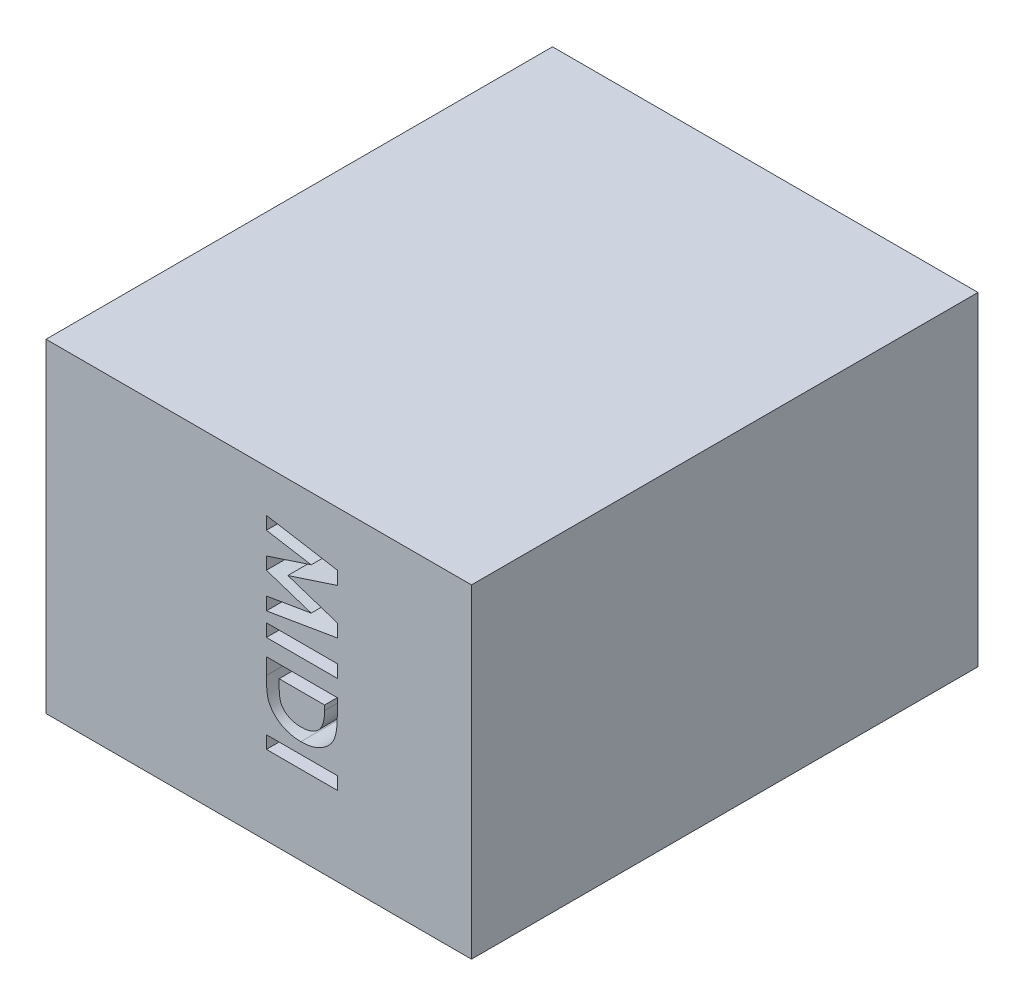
SolidWorks part; units mm, degrees
ref_plane "Plan de face" through (0, 0, 0) normal (0, 0, 1) x (1, 0, 0)
ref_plane "Plan de dessus" through (0, 0, 0) normal (0, 1, 0) x (1, 0, 0)
ref_plane "Plan de droite" through (0, 0, 0) normal (1, 0, 0) x (0, 0, -1)
sketch "Esquisse1" plane through (0, 0, 0) normal (0, 0, 1) x (1, 0, 0)
  line L1 (-34.0569, 3.6786) -> (-13.0569, 3.6786)
  line L2 (-34.0569, 3.6786) -> (-34.0569, -12.3214)
  line L3 (-34.0569, -12.3214) -> (-13.0569, -12.3214)
  line L4 (-13.0569, 3.6786) -> (-13.0569, -12.3214)
  dimension "D1" = 16
  dimension "D2" = 21
extrude "Boss.-Extru.1" add sketch "Esquisse1" along normal blind 25
sketch "Esquisse2" plane through (0, 0, 25) normal (0, 0, 1) x (1, 0, 0)
  line L0 (-23.1796, 1.6795) -> (-23.1796, -8.8179) construction
  text T0 "<b>MIDI</b>"
extrude "Boss.-Extru.2" add sketch "Esquisse2" along normal blind 4.6554
